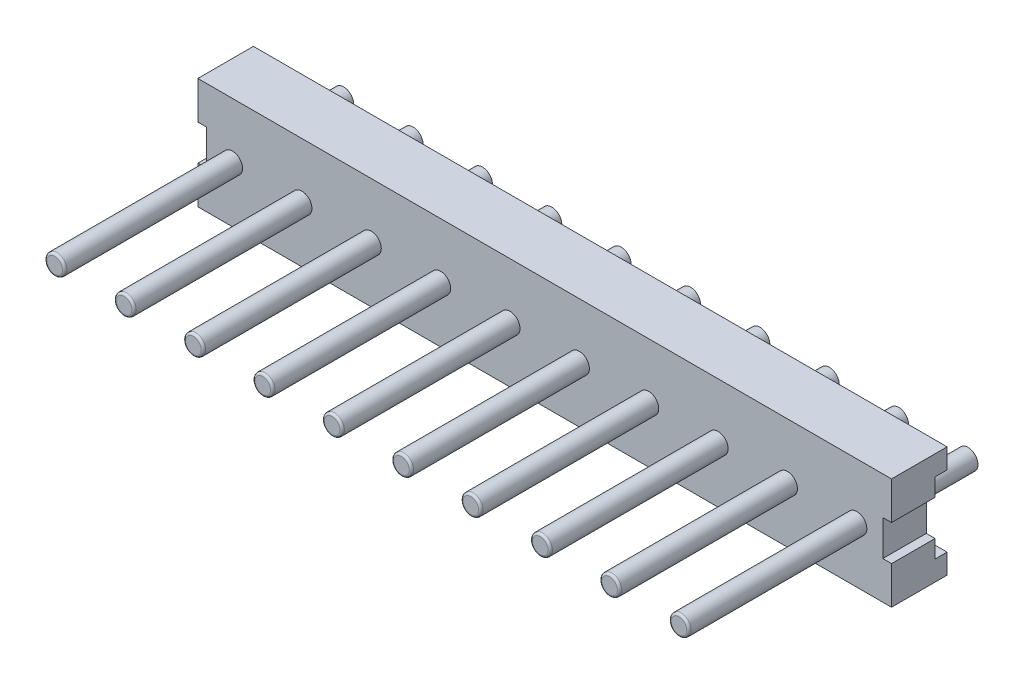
SolidWorks part; units mm, degrees
ref_plane "Front Plane" through (0, 0, 0) normal (0, 0, 1) x (1, 0, 0)
ref_plane "Top Plane" through (0, 0, 0) normal (0, 1, 0) x (1, 0, 0)
ref_plane "Right Plane" through (0, 0, 0) normal (1, 0, 0) x (0, 0, -1)
imported_body "Imported1"
fillet "Fillet1" radius 0.127
